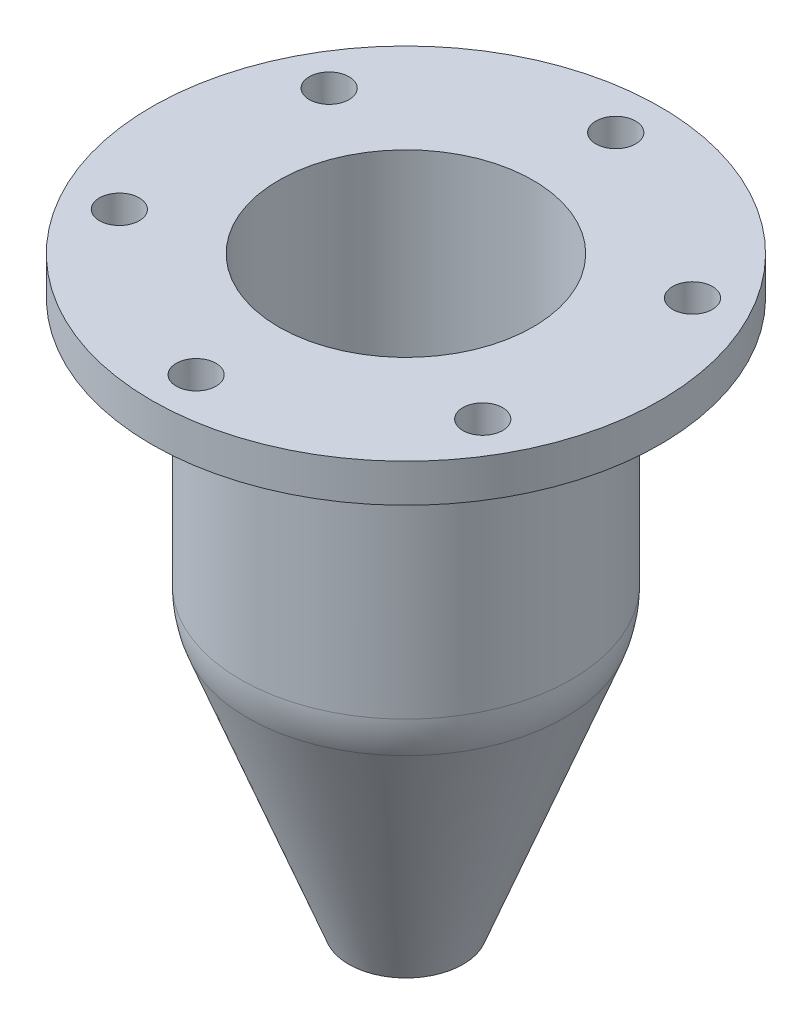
SolidWorks part; units mm, degrees
revolve "Base-Revolve" add sketch "Sketch1" angle 360 about L0
sketch "Sketch1" plane through (0, 0, 0) normal (0, 0, 1) x (1, 0, 0)
  line L0 (0, 210.3421) -> (0, -19.1018) construction
  line L1 (-11.4402, -10.4874) -> (-13.4885, 1.1293)
  line L2 (-5.2705, -4.7127) -> (-24.2693, 71.4873)
  line L4 (-24.2693, 71.4873) -> (-31.75, 71.4873)
  line L5 (-31.75, 71.4873) -> (-31.75, 147.6873)
  line L6 (-31.75, 147.6873) -> (-63.5, 147.6873)
  line L7 (-41.275, 138.1623) -> (-41.275, 71.4873)
  line L8 (-41.275, 71.4873) -> (-14.2875, 1.1293)
  line L9 (-5.2705, -4.7127) -> (-5.2705, -30.1127)
  line L10 (-63.5, 147.6873) -> (-63.5, 138.1623)
  line L11 (-63.5, 138.1623) -> (-41.275, 138.1623)
  line L12 (-5.2705, -30.1127) -> (-5.7505, -30.1127)
  line L15 (-5.7505, -30.1127) -> (-7.9637, -28.8349)
  line L16 (-7.9637, -28.8349) -> (-6.1774, -27.8036)
  line L17 (-10.3689, -28.8349) -> (-5.5585, -28.8349) construction
  line L18 (-8.4013, -26.5679) -> (-6.6157, -25.5365)
  line L19 (-6.1774, -27.8036) -> (-8.4013, -26.5679)
  line L20 (-8.8396, -24.3008) -> (-7.0557, -23.2314)
  line L21 (-6.6157, -25.5365) -> (-8.8396, -24.3008)
  line L22 (-9.1659, -22.013) -> (-7.3971, -20.9918)
  line L23 (-7.0557, -23.2314) -> (-9.1659, -22.013)
  line L24 (-9.5669, -19.739) -> (-7.798, -18.7178)
  line L25 (-7.3971, -20.9918) -> (-9.5669, -19.739)
  line L26 (-9.9679, -17.465) -> (-8.199, -16.4438)
  line L27 (-7.798, -18.7178) -> (-9.9679, -17.465)
  line L28 (-10.3689, -15.191) -> (-8.6, -14.1697)
  line L29 (-8.199, -16.4438) -> (-10.3689, -15.191)
  line L30 (-10.7698, -12.917) -> (-9.001, -11.8957)
  line L31 (-8.6, -14.1697) -> (-10.7698, -12.917)
  line L33 (-9.001, -11.8957) -> (-11.4402, -10.4874)
  line L34 (-13.4885, 1.1293) -> (-14.2875, 1.1293)
  dimension "D1" = 14
  dimension "D2" = 5.2705
  dimension "D3" = 2.3091
  dimension "D4" = 9.525
  dimension "D5" = 9.525
  dimension "D6" = 25.4
  dimension "D7" = 31.242
  dimension "D8" = 76.2
  dimension "D9" = 76.2
  dimension "D10" = 31.75
  dimension "D11" = 22.225
  dimension "D12" = 24.2693
  dimension "D13" = 63.5
  dimension "D14" = 14.2875
ref_plane "FRONT" through (0, 0, 0) normal (0, 0, 1) x (1, 0, 0)
ref_plane "TOP" through (0, 0, 0) normal (0, 1, 0) x (1, 0, 0)
ref_plane "RIGHT" through (0, 0, 0) normal (1, 0, 0) x (0, 0, -1)
sketch "Sketch2" plane through (0, 147.6873, 0) normal (0, 1, 0) x (-1, 0, 0)
  line L0 (0, 41.275) -> (0, 63.5) construction
  line L1 (0, 52.3875) -> (-65.8883, 52.3875) construction
  circle A1 centre (0, 0) radius 63.5 construction
  circle A2 centre (0, 0) radius 41.275 construction
  circle A3 centre (0, 0) radius 52.3875 construction
  circle A4 centre (0, 52.3875) radius 4.9657
  dimension "D1" = 9.9314
  dimension "D2" = 104.775
extrude "Cut-Extrude1" cut sketch "Sketch2" against normal through all
pattern_circular "CirPattern1" count 6 every 60 about axis through (0, 0, 0) along (0, 1, 0) of "Cut-Extrude1"
hole_wizard "#6-32 Tapped Hole1" positions "Sketch5" profile "Sketch4"
sketch "Sketch5" plane through (0, 71.4873, 0) normal (0, 1, 0) x (-1, 0, 0)
  point P0 (0, 27.1018)
sketch "Sketch4" plane through (0, 71.4873, 27.1018) normal (1, 0, 0) x (0, 0, 1)
  line L0 (0, 0) -> (0, 11.7855)
  line L1 (0, 11.7855) -> (1.3525, 10.9728)
  line L2 (1.3525, 10.9728) -> (1.3525, 0.0025)
  line L3 (1.3525, 0.0025) -> (1.3525, 0)
  line L5 (1.3525, 0) -> (0, 0)
  line L6 (-1.3525, 0.0025) -> (-1.3525, 0) construction
  line L10 (0, 11.7855) -> (-1.3525, 10.9728) construction
  line L11 (0, -6.35) -> (0, 107.95) construction
pattern_circular "CirPattern2" [suppressed] count 6 every 60 about axis through (0, 210.3421, 0) along (0, -1, 0)
fillet "Fillet1" radius 25.4 1 edges at (0, 71.4873, 41.275)
chamfer "Chamfer1" [suppressed] distance 0.508 angle 45
sketch "Sketch6" plane through (0, 0, 0) normal (0, 0, 1) x (1, 0, 0)
  line L0 (-14.2875, 1.1293) -> (14.2875, 1.1293) construction
  line L1 (-53.1048, 1.1293) -> (60.3853, 1.1293)
  line L2 (-53.1048, 1.1293) -> (-53.1048, -45.266)
  line L3 (-53.1048, -45.266) -> (60.3853, -45.266)
  line L4 (60.3853, 1.1293) -> (60.3853, -45.266)
extrude "Extrude1" cut sketch "Sketch6" against normal mid plane 76.2
